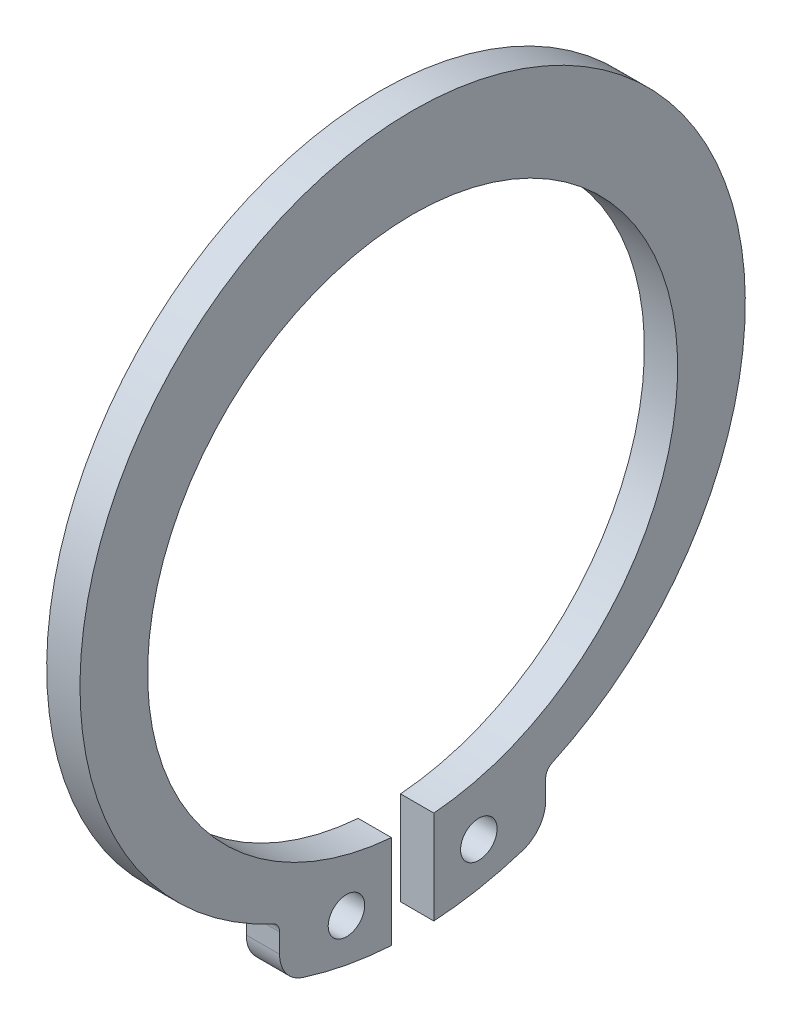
SolidWorks part; units mm, degrees
ref_plane "frontal" through (0, 0, 0) normal (0, 0, 1) x (1, 0, 0)
ref_plane "horizontal" through (0, 0, 0) normal (0, 1, 0) x (1, 0, 0)
ref_plane "profil" through (0, 0, 0) normal (1, 0, 0) x (0, 0, -1)
sketch "Esquisse1" plane through (0, 0, 0) normal (1, 0, 0) x (0, 0, -1)
  line L0 (0.956, -11.9117) -> (0.956, -16.1272)
  line L1 (6, -13.0712) -> (6, -13.9475)
  line L2 (0, -11) -> (0, -19) construction
  line L3 (-6, -13.0712) -> (-6, -13.9475)
  line L4 (-0.956, -11.9117) -> (-0.956, -16.1272)
  arc A0 (0.956, -11.9117) -> (-0.956, -11.9117) centre (0, 0) ccw
  arc A2 (0.956, -16.1272) -> (4.9606, -15.3751) centre (0, 0) ccw
  arc A3 (6.2903, -12.6173) -> (-6.2903, -12.6173) centre (0, 1) ccw
  arc A4 (6, -13.9475) -> (4.9606, -15.3751) centre (4.5, -13.9475) cw
  arc A5 (6, -13.0712) -> (6.2903, -12.6173) centre (6.5, -13.0712) cw
  circle A6 centre (2.9839, -13.9475) radius 0.8231
  circle A7 centre (-2.9839, -13.9475) radius 0.8231
  arc A8 (-6, -13.9475) -> (-4.9606, -15.3751) centre (-4.5, -13.9475) ccw
  arc A9 (-0.956, -16.1272) -> (-4.9606, -15.3751) centre (0, 0) cw
  arc A10 (-6, -13.0712) -> (-6.2903, -12.6173) centre (-6.5, -13.0712) ccw
  dimension "D1" = 23.9
  dimension "D3" = 1.5
  dimension "D4" = 0.5
extrude "Base-Extrusion" add sketch "Esquisse1" along normal blind 1.5
